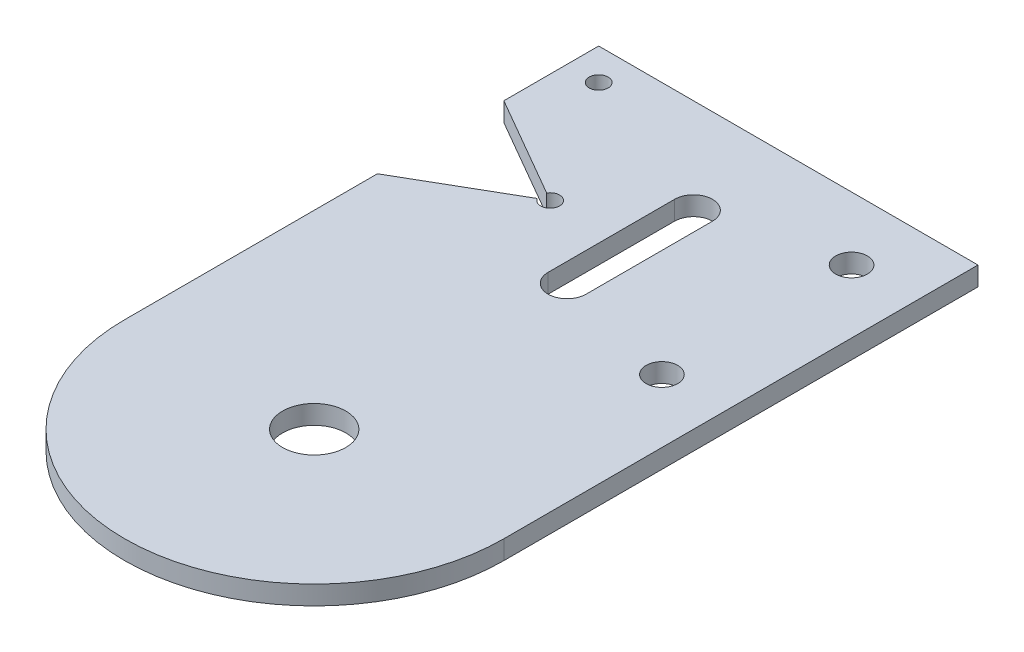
SolidWorks part; units mm, degrees
ref_plane "Front" through (0, 0, 0) normal (0, 0, 1) x (1, 0, 0)
ref_plane "Top" through (0, 0, 0) normal (0, 1, 0) x (1, 0, 0)
ref_plane "Right" through (0, 0, 0) normal (1, 0, 0) x (0, 0, -1)
sketch "Sketch1" plane through (0, 0, 0) normal (0, 1, 0) x (1, 0, 0)
  line L0 (27, 70) -> (27, 90)
  line L2 (0, 30) -> (0, 70)
  line L3 (0, 105) -> (60, 105)
  line L4 (60, 30) -> (60, 105)
  line L5 (33, 70) -> (33, 90)
  line L10 (0, 90) -> (16.0215, 80.75)
  line L11 (0, 70) -> (16.0215, 79.25)
  line L12 (0, 90) -> (0, 105)
  arc A0 (0, 30) -> (60, 30) centre (30, 30) ccw
  circle A1 centre (30, 30) radius 5
  circle A3 centre (50, 95) radius 2.5
  circle A4 centre (50, 65) radius 2.5
  circle A5 centre (5, 100) radius 1.5
  arc A6 (33, 90) -> (27, 90) centre (30, 90) ccw
  arc A7 (27, 70) -> (33, 70) centre (30, 70) ccw
  arc A8 (16.0215, 79.25) -> (16.0215, 80.75) centre (17.3205, 80) ccw
extrude "Extrude1" add sketch "Sketch1" along normal blind 3
